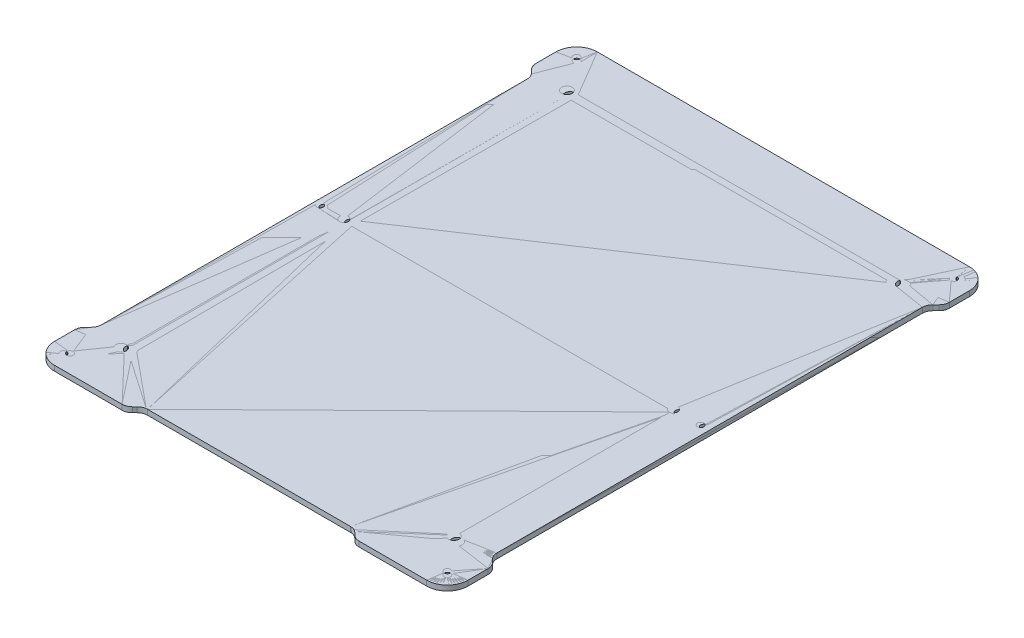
SolidWorks part; units mm, degrees
ref_plane "Front Plane" through (0, 0, 0) normal (0, 0, 1) x (1, 0, 0)
ref_plane "Top Plane" through (0, 0, 0) normal (0, 1, 0) x (1, 0, 0)
ref_plane "Right Plane" through (0, 0, 0) normal (1, 0, 0) x (0, 0, -1)
sketch "Sketch1" plane through (0, 0, 0) normal (0, 1, 0) x (1, 0, 0)
  line L0 (-160, 210) -> (-160, -210)
  line L1 (-160, -210) -> (160, -210)
  line L2 (160, -210) -> (160, 210)
  line L3 (160, 210) -> (-160, 210)
  line L4 (0, -210) -> (0, 210) construction
  line L5 (-160, 0) -> (160, 0) construction
  line L6 (-130, 137.3639) -> (-130, -210) construction
  circle A5 centre (-130, -172.5) radius 4.1
  circle A6 centre (130, -172.5) radius 4.1
  circle A7 centre (-130, 0) radius 3.4
  circle A8 centre (130, 0) radius 3.4
  circle A9 centre (130, 172.5) radius 4.1
  circle A10 centre (-130, 172.5) radius 4.1
  circle A11 centre (130, -172.5) radius 7 construction
  point P8 (0, 0)
  point P12 (0, 0)
extrude "BaseProfile" add sketch "Sketch1" against normal blind 4
fillet "Major-Fillet" radius 16
sketch "Sketch6" plane through (0, 0, 0) normal (0, 1, 0) x (1, 0, 0)
  line L0 (0, 210) -> (0, -210) construction
  line L1 (144, 210) -> (-144, 210) construction
  line L2 (-144, -210) -> (144, -210) construction
  line L3 (160, 0) -> (-160, 0) construction
  line L4 (160, -194) -> (160, 194) construction
  line L5 (-160, 194) -> (-160, -194) construction
  line L6 (-152.9289, -168) -> (-152.9289, 168)
  line L7 (-152.9289, -168) -> (-167.0711, -182.1421)
  line L8 (-152.9289, 168) -> (-167.0711, 182.1421)
  line L9 (-167.0711, -182.1421) -> (-167.0711, 182.1421)
  line L10 (-152.9289, 0) -> (-167.0711, 0) construction
  point P13 (-160, 0)
extrude "Cutouts-Side" cut sketch "Sketch6" against normal blind 10
sketch "Sketch7" plane through (0, 0, 0) normal (0, 1, 0) x (1, 0, 0)
  line L0 (0, 210) -> (0, -210) construction
  line L1 (144, 210) -> (-144, 210) construction
  line L2 (-144, -210) -> (144, -210) construction
  line L4 (-81.8579, -203.4912) -> (81.8579, -203.4912)
  line L5 (-81.8579, -203.4912) -> (-96, -217.6333)
  line L6 (-96, -217.6333) -> (96, -217.6333)
  line L7 (81.8579, -203.4912) -> (96, -217.6333)
  line L8 (-81.8579, -203.4912) -> (96, -217.6333) construction
  line L9 (-96, -217.6333) -> (81.8579, -203.4912) construction
extrude "Cutouts-Front" cut sketch "Sketch7" against normal blind 10
mirror "Mirror2" about plane through (0, 0, 0) normal (1, 0, 0)
fillet "Minor-Fillets" radius 8
sketch "Sketch8" plane through (0, -4, 0) normal (0, -1, 0) x (1, 0, 0)
  line L0 (0, 198.5) -> (0, -198.5) construction
  line L1 (148.5, 198.5) -> (-148.5, 198.5) construction
  line L2 (148.5, 198.5) -> (148.5, -198.5) construction
  line L3 (148.5, -198.5) -> (-148.5, -198.5) construction
  line L4 (-148.5, 198.5) -> (-148.5, -198.5) construction
  line L5 (148.5, 198.5) -> (-148.5, -198.5) construction
  line L6 (148.5, -198.5) -> (-148.5, 198.5) construction
  line L7 (148.5, 0) -> (-148.5, 0) construction
  circle A0 centre (-148.5, 198.5) radius 2.5
  circle A1 centre (148.5, 198.5) radius 2.5
  circle A2 centre (148.5, -198.5) radius 2.5
  circle A3 centre (-148.5, -198.5) radius 2.5
  circle A4 centre (-148.5, 0) radius 2.5
  circle A5 centre (148.5, 0) radius 2.5
  point P0 (0, 0)
extrude "Chain-Holes" cut sketch "Sketch8" against normal blind 10
equation "\"Base-Width\"= 420"
equation "\"Base-Height\"= 320"
equation "\"Support-Rod-Diameter\"= 16"
equation "\"Support-Rod-X-Offset\"= 35"
equation "\"Support-Rod-Y-Offset\"= 35"
equation "\"Base-Thickness\"= 5"
equation "\"Base-Depth\"= 82"
equation "\"D1@Sketch1\"=\"Base-Height\""
equation "\"Corner-Radius-Major\"= \"Support-Rod-Diameter\""
equation "\"D1@Major-Fillet\" = \"Corner-Radius-Major\""
equation "\"D1@Sketch8\" = \"Base-Height\" - \"Support-Rod-Y-Offset\" + 12"
equation "\"D2@Sketch8\"= \"Base-Width\" - ( \"Support-Rod-X-Offset\" ) + 12"
equation "\"Cutout-Horizontal\"= \"Base-Width\" * 0.8"
equation "\"Cutout-Vertical\"= \"Base-Height\" * 0.6"
equation "\"Outer-Support-Bore-Diameter\"= 6.1"
equation "\"D2@Sketch6\"=\"Cutout-Horizontal\""
equation "\"D1@Sketch7\"=\"Cutout-Vertical\""
equation "\"Inner-Support-Bore-Diameter\"= 8.2"
equation "\"Cutout-Depth\"= 20"
equation "\"D1@Sketch6\"=\"Cutout-Depth\""
equation "\"D2@Sketch7\"=\"Cutout-Depth\""
equation "\"D4@Sketch1\"=\"Inner-Support-Bore-Diameter\""
equation "\"D1@Minor-Fillets\"=\"Corner-Radius-Major\" / 2"
equation "\"Base-Width-Medium\"= 520"
equation "\"D2@Sketch1\"=\"Base-Width\""
